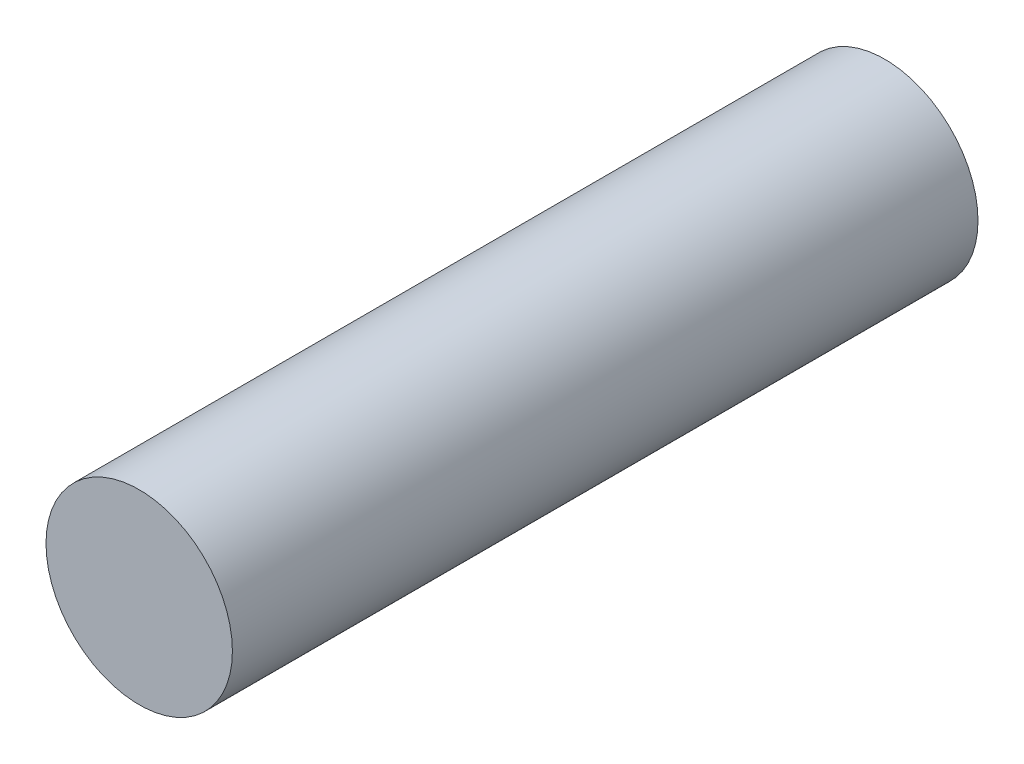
SolidWorks part; units mm, degrees
ref_plane "front" through (0, 0, 0) normal (0, 0, 1) x (1, 0, 0)
ref_plane "top" through (0, 0, 0) normal (0, 1, 0) x (1, 0, 0)
ref_plane "side" through (0, 0, 0) normal (1, 0, 0) x (0, 0, -1)
sketch "Sketch1" plane through (0, 0, 0) normal (0, 0, 1) x (1, 0, 0)
  circle A0 centre (0, 0) radius 9.525
  dimension "D1" = 19.05
extrude "Base-Extrude" add sketch "Sketch1" along normal blind 76.2
